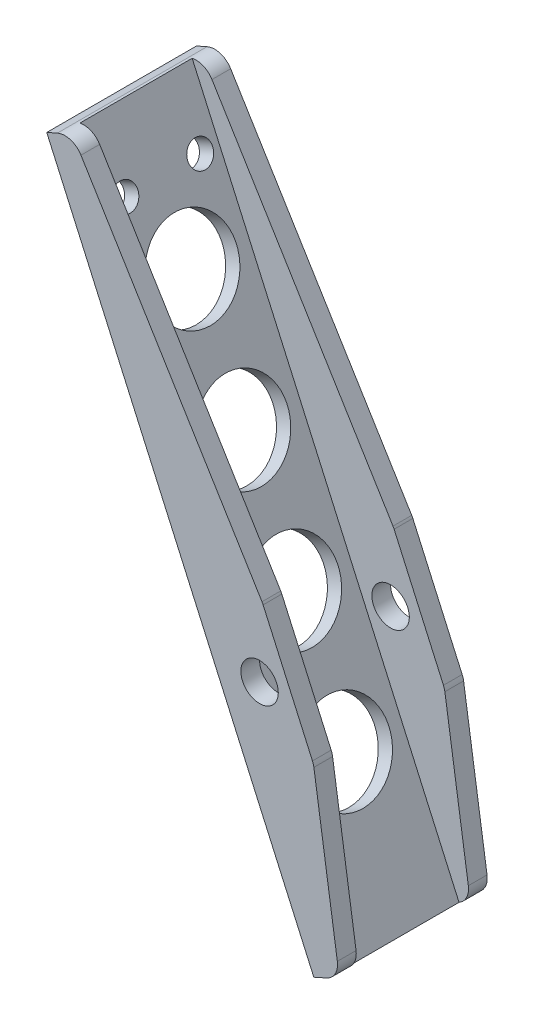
SolidWorks part; units mm, degrees
ref_plane "Plan de face" through (0, 0, 0) normal (0, 0, 1) x (1, 0, 0)
ref_plane "Plan de dessus" through (0, 0, 0) normal (0, 1, 0) x (1, 0, 0)
ref_plane "Plan de droite" through (0, 0, 0) normal (1, 0, 0) x (0, 0, -1)
sketch "Esquisse1" plane through (0, 0, -3) normal (0, 0, 1) x (1, 0, 0)
  line L2 (8.6953, -5.9096) -> (-34.1189, 89.965)
  line L3 (-34.1189, 89.965) -> (-23.1618, 94.8581)
  line L4 (-23.1618, 94.8581) -> (19.6524, -1.0166)
  line L5 (19.6524, -1.0166) -> (8.6953, -5.9096)
  circle A0 centre (0, 30.729) radius 3
  dimension "D1" = 6
  dimension "D2" = 105
  dimension "D3" = 12
  dimension "D4" = 5
  dimension "D7" = 68
extrude "Boss.-Extru.1" add sketch "Esquisse1" against normal blind 3
sketch "Esquisse3" plane through (0, 0, -6) normal (0, 0, -1) x (-1, 0, 0)
  line L0 (34.1189, 89.965) -> (-8.6953, -5.9096)
  line L1 (-8.6953, -5.9096) -> (-10.978, -4.8902)
  line L2 (-8.6953, -5.9096) -> (-19.6524, -1.0166) construction
  line L3 (-10.978, -4.8902) -> (31.8362, 90.9844)
  line L4 (23.1618, 94.8581) -> (34.1189, 89.965) construction
  line L5 (31.8362, 90.9844) -> (34.1189, 89.965)
  dimension "D1" = 2.5
extrude "Boss.-Extru.2" add sketch "Esquisse3" along normal blind 18
sketch "Esquisse4" plane through (0, 0, -24) normal (0, 0, -1) x (-1, 0, 0)
  line L4 (-19.6524, -1.0166) -> (-8.6953, -5.9096)
  line L5 (23.1618, 94.8581) -> (-19.6524, -1.0166)
  line L6 (34.1189, 89.965) -> (23.1618, 94.8581)
  line L7 (-8.6953, -5.9096) -> (34.1189, 89.965)
  line L8 (-19.6524, -1.0166) -> (-8.6953, -5.9096)
  line L9 (23.1618, 94.8581) -> (-19.6524, -1.0166)
  line L10 (34.1189, 89.965) -> (23.1618, 94.8581)
  line L11 (-8.6953, -5.9096) -> (34.1189, 89.965)
  circle A0 centre (0, 30.729) radius 3 construction
  circle A1 centre (0, 30.729) radius 3
  dimension "D1" = 0
extrude "Boss.-Extru.3" add sketch "Esquisse4" along normal blind 3
sketch "Esquisse5" plane through (0, 0, -3) normal (0, 0, 1) x (1, 0, 0)
  line L0 (19.6524, -1.0166) -> (-23.1618, 94.8581) construction
  line L1 (-8.1628, 61.2705) -> (-17.7035, 82.6351)
  arc A0 (-8.1628, 61.2705) -> (-17.7035, 82.6351) centre (-12.6754, 72.0679) ccw
sketch "Esquisse6" plane through (0, 0, -24) normal (0, 0, 1) x (1, 0, 0)
  line L1 (-17.7035, 82.6351) -> (-8.1628, 61.2705)
  line L2 (-17.7035, 82.6351) -> (-8.1628, 61.2705)
  arc A1 (-8.1628, 61.2705) -> (-17.7035, 82.6351) centre (-12.6754, 72.0679) ccw
  arc A2 (-8.1628, 61.2705) -> (-17.7035, 82.6351) centre (-12.6754, 72.0679) ccw
  dimension "D1" = 0
fillet "Congé1" radius 3 2 edges at (19.6524, -1.0166, -25.5) (19.6524, -1.0166, -4.5)
sketch "Esquisse7" plane through (5.0493, 2.2548, 0) normal (-0.9131, -0.4078, 0) x (0, 0, 1)
  line L0 (-15, 96.0584) -> (-15, 69.5886) construction
  line L1 (-45, 96.0584) -> (15, 96.0584)
  line L2 (-45, 96.0584) -> (-45, 76.0584)
  line L3 (-45, 76.0584) -> (15, 76.0584)
  line L4 (15, 96.0584) -> (15, 76.0584)
  line L5 (-27, -8.9416) -> (-27, 96.0584) construction
  line L6 (-3, 96.0584) -> (-3, -8.9416) construction
  dimension "D1" = 60
  dimension "D2" = 20
sketch "Esquisse8" plane through (5.0493, 2.2548, 0) normal (-0.9131, -0.4078, 0) x (0, 0, 1)
  circle A0 centre (-9, 85.4673) radius 2 construction
  circle A1 centre (-21, 85.4673) radius 2 construction
  circle A2 centre (-9, 85.4673) radius 2
  circle A3 centre (-21, 85.4673) radius 2
extrude "Enlèv. mat.-Extru.1" cut sketch "Esquisse8" against normal blind 4
fillet "Congé2" radius 3 2 edges at (-23.1618, 94.8581, -25.5) (-23.1618, 94.8581, -4.5)
sketch "Esquisse9" plane through (0, 0, -3) normal (0, 0, 1) x (1, 0, 0)
  line L0 (0.4879, 41.8987) -> (-30.01, 91.7999)
  line L1 (18.4291, 1.7227) -> (-21.9386, 92.1188) construction
  line L2 (-25.9011, 93.6348) -> (-34.1189, 89.965) construction
  line L3 (8.643, 23.6369) -> (12.8042, -4.0747)
  line L4 (8.6953, -5.9096) -> (16.9131, -2.2398) construction
  line L5 (0, 30.729) -> (4.5655, 32.7678) construction
  line L6 (-25.9011, 93.6348) -> (-30.01, 91.7999)
  line L7 (18.4291, 1.7227) -> (8.643, 23.6369)
  line L8 (12.8042, -4.0747) -> (16.9131, -2.2398)
  line L9 (0.4879, 41.8987) -> (-21.9386, 92.1188)
  arc A0 (-21.9386, 92.1188) -> (-25.9011, 93.6348) centre (-24.6778, 90.8955) ccw construction
  arc A1 (16.9131, -2.2398) -> (18.4291, 1.7227) centre (15.6898, 0.4994) ccw construction
  arc A2 (-21.9386, 92.1188) -> (-25.9011, 93.6348) centre (-24.6778, 90.8955) ccw
  arc A3 (16.9131, -2.2398) -> (18.4291, 1.7227) centre (15.6898, 0.4994) ccw
  dimension "D1" = 20
extrude "Enlèv. mat.-Extru.2" cut sketch "Esquisse9" against normal through all
fillet "Congé3" radius 3 6 edges at (-30.01, 91.7999, -25.5) (0.4879, 41.8987, -4.5) (0.4879, 41.8987, -25.5) (8.643, 23.6369, -4.5) (8.643, 23.6369, -25.5) (12.8042, -4.0747, -25.5)
sketch "Esquisse10" plane through (5.0493, 2.2548, 0) normal (-0.9131, -0.4078, 0) x (0, 0, 1)
  line L0 (-15, 96.0584) -> (-15, 69.5886) construction
  circle A0 centre (-15, 73.8171) radius 7.0463
  circle A1 centre (-15, 53.8171) radius 7.0463
  circle A2 centre (-15, 33.8171) radius 7.0463
  circle A3 centre (-15, 13.8171) radius 7.0463
  dimension "D1" = 4
extrude "Enlèv. mat.-Extru.3" cut sketch "Esquisse10" against normal blind 20
